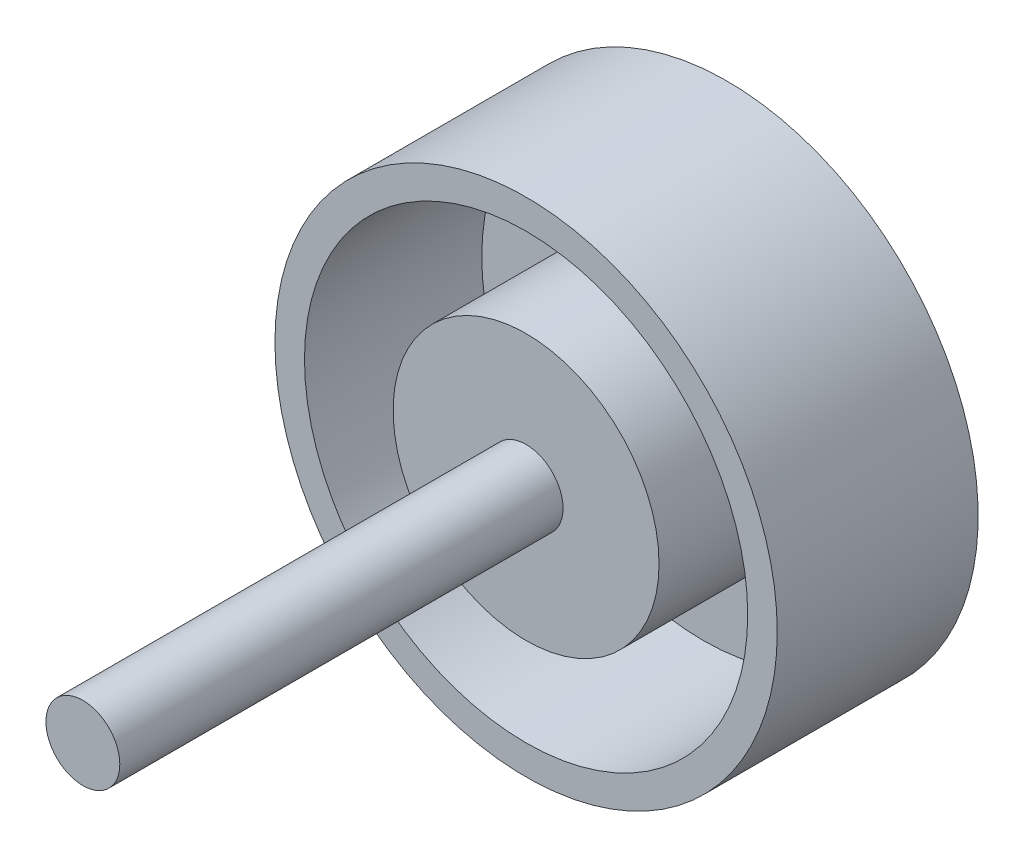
SolidWorks part; units mm, degrees
ref_plane "Plan1" through (0, 0, 0) normal (0, 0, 1) x (1, 0, 0)
ref_plane "Plan2" through (0, 0, 0) normal (0, 1, 0) x (1, 0, 0)
ref_plane "Plan3" through (0, 0, 0) normal (1, 0, 0) x (0, 0, -1)
sketch "Esquisse1" plane through (0, 0, 0) normal (0, 0, 1) x (1, 0, 0)
  circle A0 centre (0, 0) radius 8.5
  dimension "D1" = 17
extrude "Base-Extrusion" add sketch "Esquisse1" along normal blind 7
sketch "Esquisse2" plane through (0, 0, 7) normal (0, 0, 1) x (1, 0, 0)
  circle A0 centre (0, 0) radius 7.5
  circle A1 centre (0, 0) radius 4.5
  dimension "D1" = 15
  dimension "D2" = 9
extrude "Enlèv. mat.-Extru.1" cut sketch "Esquisse2" against normal blind 6
sketch "Esquisse3" plane through (0, 0, 7) normal (0, 0, 1) x (1, 0, 0)
  circle A0 centre (0, 0) radius 1.25
  dimension "D1" = 2.5
extrude "Boss.-Extru.1" add sketch "Esquisse3" along normal blind 15
sketch "Esquisse4" plane through (0, 0, 0) normal (0, 0, -1) x (-1, 0, 0)
  circle A0 centre (0, 0) radius 6
  dimension "D1" = 12
extrude "Enlèv. mat.-Extru.2" cut sketch "Esquisse4" against normal blind 0.5
sketch "Esquisse5" plane through (0, 0, 0) normal (0, 0, -1) x (-1, 0, 0)
  circle A0 centre (0, 0) radius 7
  circle A1 centre (0, 0) radius 8.5
  dimension "D1" = 14
extrude "Enlèv. mat.-Extru.3" cut sketch "Esquisse5" against normal blind 0.2
